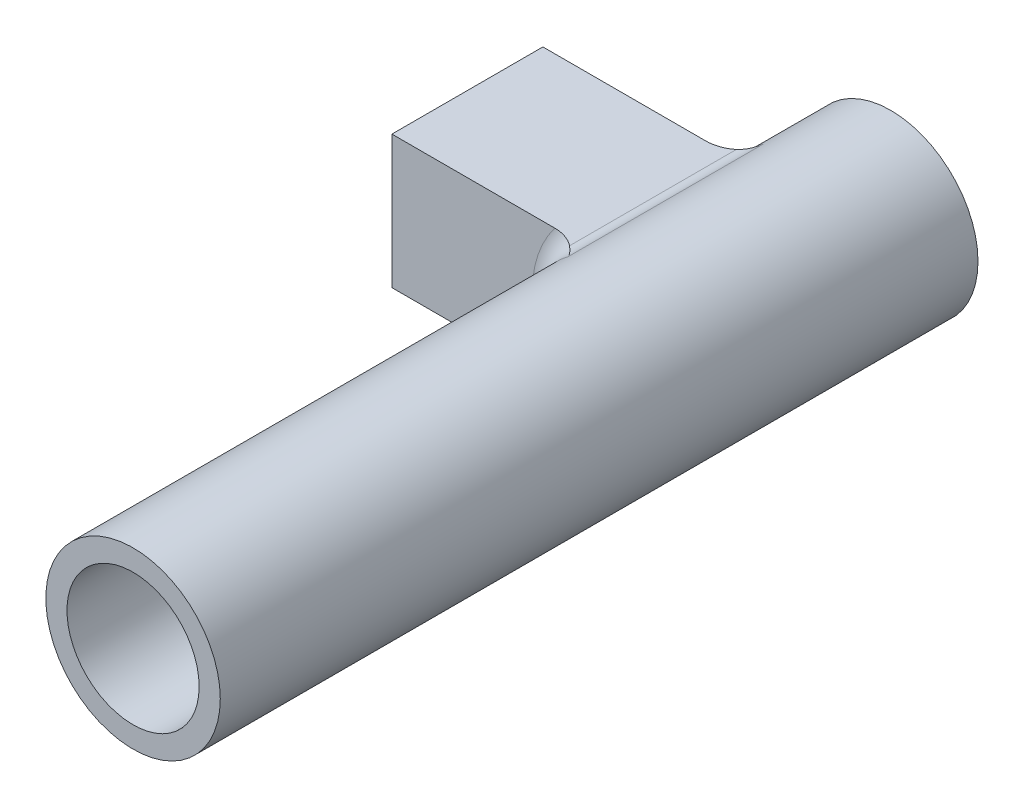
SolidWorks part; units mm, degrees
ref_plane "Front Plane" through (0, 0, 0) normal (0, 0, 1) x (1, 0, 0)
ref_plane "Top Plane" through (0, 0, 0) normal (0, 1, 0) x (1, 0, 0)
ref_plane "Right Plane" through (0, 0, 0) normal (1, 0, 0) x (0, 0, -1)
sketch "Sketch1" plane through (0, 0, 0) normal (0, 1, 0) x (1, 0, 0)
  line L0 (0, 64.5115) -> (0, -55.4885) construction
  line L2 (0, 77.0555) -> (-56.6508, 77.0555) construction
ref_plane "Plane1" through (0, 0, 55.4885) normal (0, 0, 1) x (1, 0, 0)
ref_plane "Plane2" through (-56.6508, 0, -77.0555) normal (-1, 0, 0) x (0, 0, 1)
sketch "Sketch2" plane through (0, 0, 55.4885) normal (0, 0, 1) x (1, 0, 0)
  circle A0 centre (0, 0) radius 19.8
  circle A1 centre (0, 0) radius 15
extrude "Boss-Extrude1" add sketch "Sketch2" against normal blind 170
sketch "Sketch3" plane through (-56.6508, 0, -77.0555) normal (-1, 0, 0) x (0, 0, 1)
  line L1 (17.1367, 15.0968) -> (-17.1367, 15.0968)
  line L2 (17.1367, 15.0968) -> (17.1367, -15.0968)
  line L3 (17.1367, -15.0968) -> (-17.1367, -15.0968)
  line L4 (-17.1367, 15.0968) -> (-17.1367, -15.0968)
  line L5 (17.1367, 15.0968) -> (-17.1367, -15.0968) construction
  line L6 (17.1367, -15.0968) -> (-17.1367, 15.0968) construction
  circle A0 centre (0, 0) radius 12.5
  point P0 (0, 0)
sketch "Sketch4" plane through (0, 0, -114.5115) normal (0, 0, -1) x (-1, 0, 0)
  circle A0 centre (0, 0) radius 19.8
extrude "Boss-Extrude3" add sketch "Sketch4" along normal blind 2
sketch "Sketch5" plane through (0, 0, -116.5115) normal (0, 0, -1) x (-1, 0, 0)
  circle A0 centre (0, 0) radius 12
extrude "Boss-Extrude4" add sketch "Sketch5" along normal blind 1
fillet "Fillet2" radius 1 1 edges at (-12, 0, -117.5115)
extrude "Boss-Extrude5" add sketch "Sketch3" against normal up to body separate body
fillet "Fillet3" radius 5 4 edges at (-12.8112, -15.0968, -77.0555) (-19.8, 0, -59.9189) (-19.8, 0, -94.1922) (-12.8112, 15.0968, -77.0555)
equation "\"20mmmm\"=21.4677"
